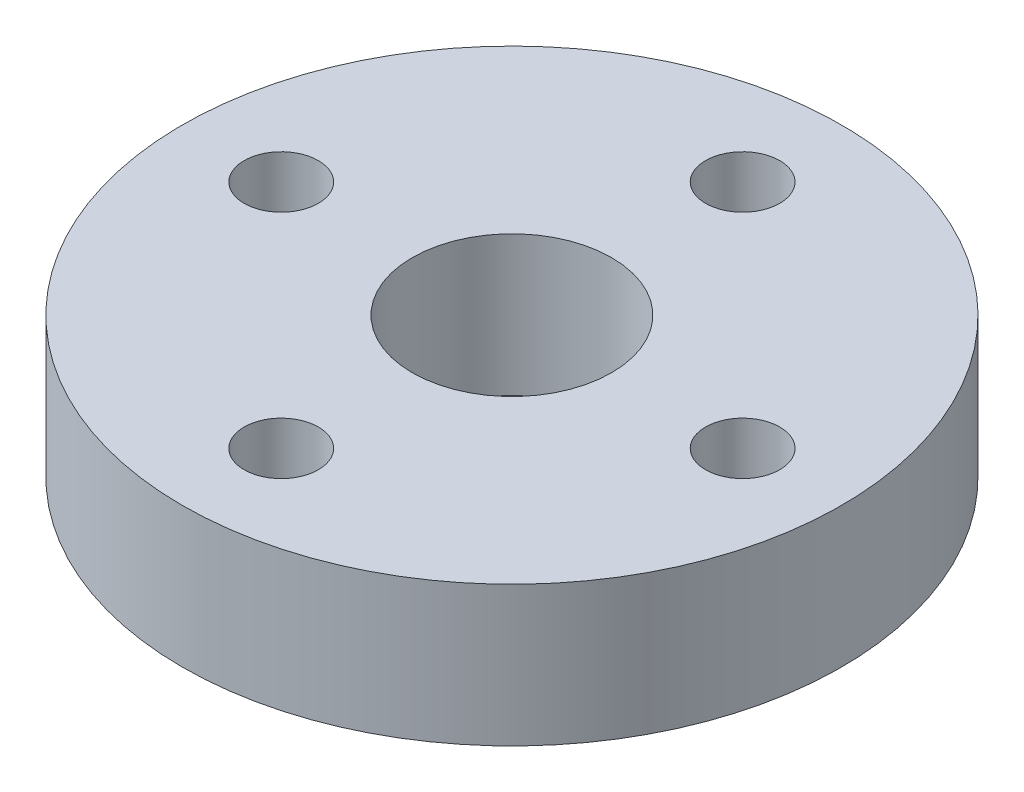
SolidWorks part; units mm, degrees
ref_plane "Front Plane" through (0, 0, 0) normal (0, 0, 1) x (1, 0, 0)
ref_plane "Top Plane" through (0, 0, 0) normal (0, 1, 0) x (1, 0, 0)
ref_plane "Right Plane" through (0, 0, 0) normal (1, 0, 0) x (0, 0, -1)
sketch "Sketch1" plane through (0, 0, 0) normal (0, 1, 0) x (1, 0, 0)
  circle A0 centre (0, 0) radius 10
  circle A1 centre (0, 0) radius 3.025
  dimension "D1" = 20
  dimension "D2" = 6.05
extrude "Boss-Extrude1" add sketch "Sketch1" along normal blind 4.25
sketch "Sketch3" plane through (0, 0, 0) normal (0, -1, 0) x (1, 0, 0)
  line L0 (0, 0) -> (0, 7) construction
  line L1 (7, 2.3094) -> (5, 1.1547)
  line L2 (-2.3094, 7) -> (-1.1547, 5)
  line L3 (-1.1547, 5) -> (1.1547, 5)
  line L4 (1.1547, 5) -> (2.3094, 7)
  line L5 (2.3094, 7) -> (1.1547, 9)
  line L6 (1.1547, 9) -> (-1.1547, 9)
  line L7 (-1.1547, 9) -> (-2.3094, 7)
  line L8 (5, 1.1547) -> (5, -1.1547)
  line L9 (5, -1.1547) -> (7, -2.3094)
  line L10 (7, -2.3094) -> (9, -1.1547)
  line L11 (9, -1.1547) -> (9, 1.1547)
  line L12 (9, 1.1547) -> (7, 2.3094)
  line L13 (0, 0) -> (7, 0) construction
  line L14 (2.3094, -7) -> (1.1547, -5)
  line L15 (1.1547, -5) -> (-1.1547, -5)
  line L16 (-1.1547, -5) -> (-2.3094, -7)
  line L17 (-2.3094, -7) -> (-1.1547, -9)
  line L18 (-1.1547, -9) -> (1.1547, -9)
  line L19 (1.1547, -9) -> (2.3094, -7)
  line L20 (0, 0) -> (0, -7) construction
  line L21 (-7, -2.3094) -> (-5, -1.1547)
  line L22 (-5, -1.1547) -> (-5, 1.1547)
  line L23 (-5, 1.1547) -> (-7, 2.3094)
  line L24 (-7, 2.3094) -> (-9, 1.1547)
  line L25 (-9, 1.1547) -> (-9, -1.1547)
  line L26 (-9, -1.1547) -> (-7, -2.3094)
  line L27 (0, 0) -> (-7, 0) construction
  circle A0 centre (0, 7) radius 2 construction
  circle A1 centre (7, 0) radius 2 construction
  circle A2 centre (0, -7) radius 2 construction
  circle A3 centre (-7, 0) radius 2 construction
  point P28 (0, 0)
  dimension "D1" = 4
  dimension "D2" = 14
  dimension "D3" = 4
extrude "Cut-Extrude1" cut sketch "Sketch3" against normal blind 2
sketch "Sketch4" plane through (0, 2, 0) normal (0, -1, 0) x (1, 0, 0)
  circle A0 centre (0, -7) radius 1.125
  circle A1 centre (0, 7) radius 1.125
  circle A2 centre (7, 0) radius 1.125
  circle A3 centre (-7, 0) radius 1.125
  dimension "D1" = 2.25
extrude "Cut-Extrude2" cut sketch "Sketch4" against normal through all
sketch "Sketch5" plane through (0, 0, 0) normal (0, -1, 0) x (1, 0, 0)
  circle A0 centre (0, 0) radius 10 construction
  circle A1 centre (7, 0) radius 1.125 construction
  circle A2 centre (0, -7) radius 1.125 construction
  circle A3 centre (-7, 0) radius 1.125 construction
  circle A4 centre (0, 7) radius 1.125 construction
  circle A5 centre (0, 0) radius 10
  circle A6 centre (7, 0) radius 1.125
  circle A7 centre (0, -7) radius 1.125
  circle A8 centre (-7, 0) radius 1.125
  circle A9 centre (0, 7) radius 1.125
  circle A10 centre (0, 0) radius 3.025 construction
  circle A11 centre (0, 0) radius 3.025
extrude "Boss-Extrude2" add sketch "Sketch5" against normal up to surface (4.25 mm away)
shell "Shell1" thickness 1
